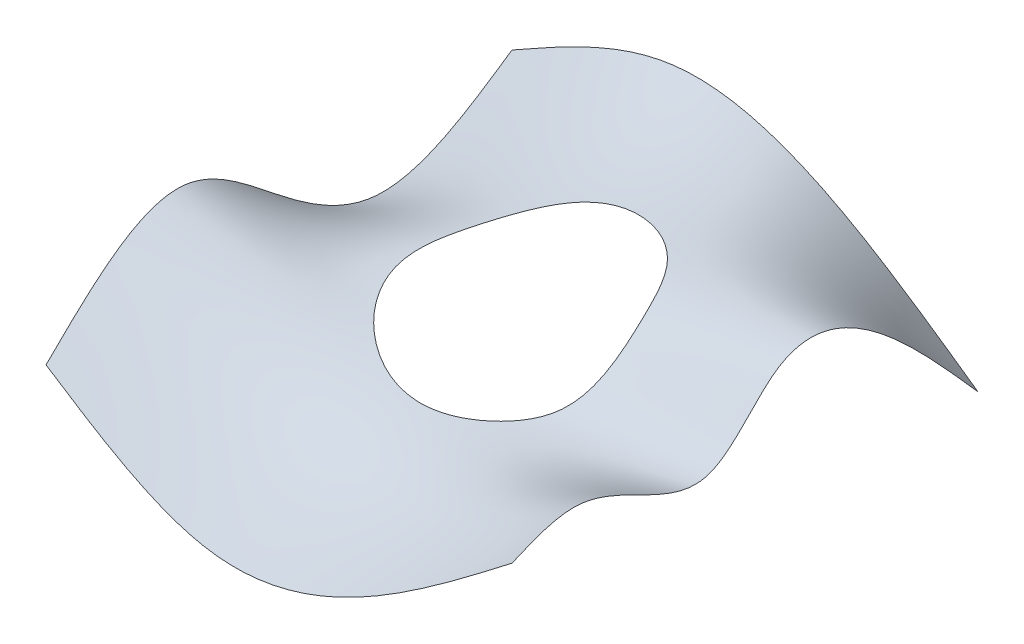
SolidWorks part; units mm, degrees
ref_plane "Front Plane" through (0, 0, 0) normal (0, 0, 1) x (1, 0, 0)
ref_plane "Top Plane" through (0, 0, 0) normal (0, 1, 0) x (1, 0, 0)
ref_plane "Right Plane" through (0, 0, 0) normal (1, 0, 0) x (0, 0, -1)
ref_plane "Plane1" through (127, 0, 0) normal (1, 0, 0) x (0, 0, -1)
ref_plane "Plane2" through (0, 0, -127) normal (0, 0, 1) x (1, 0, 0)
sketch "Sketch1" plane through (0, 0, 0) normal (1, 0, 0) x (0, 0, -1)
  line L0 (0, 50) -> (0, -50) construction
  line L1 (127, 50) -> (127, -50) construction
  spline S0 degree 3 poles (0, 8.7647) (12.6288, 21.2508) (35.213, 43.58) (63.9182, 14.9336) (94.3977, -2.5947) (114.3835, 11.002) (127, 19.5853) knots 0 0 0 0 0.308085 0.550955 0.716529 1 1 1 1
sketch "Sketch2" plane through (0, 0, 0) normal (0, 0, 1) x (1, 0, 0)
  line L0 (127, -50) -> (127, 50) construction
  spline S0 degree 3 poles (0, 8.7647) (14.9784, -0.9679) (57.1298, -28.3568) (99.6131, 4.3612) (127, 25.453) knots 0 0 0 0 0.355349 1 1 1 1
sketch "Sketch3" plane through (0, 0, -127) normal (0, 0, 1) x (1, 0, 0)
  line L0 (127, -50) -> (127, 50) construction
  spline S0 degree 3 poles (0, 19.5853) (14.4998, 27.7963) (56.8798, 51.7954) (99.1753, 22.0022) (127, 2.4025) knots 0 0 0 0 0.342138 1 1 1 1
sketch "Sketch4" plane through (127, 0, 0) normal (1, 0, 0) x (0, 0, -1)
  spline S0 degree 3 poles (0.2925, 24.5339) (6.4241, 27.2062) (24.0816, 34.9019) (51.8135, 7.4774) (80.9246, 54.15) (107.6745, 24.107) (127, 2.4025) knots 0 0 0 0 0.134025 0.385962 0.556389 1 1 1 1
surface "Surface-Loft1"
sketch "Sketch5" plane through (0, 0, 0) normal (0, 1, 0) x (1, 0, 0)
  circle A0 centre (63.7923, 65.5464) radius 28.3105
surface "Surface-Trim1"
